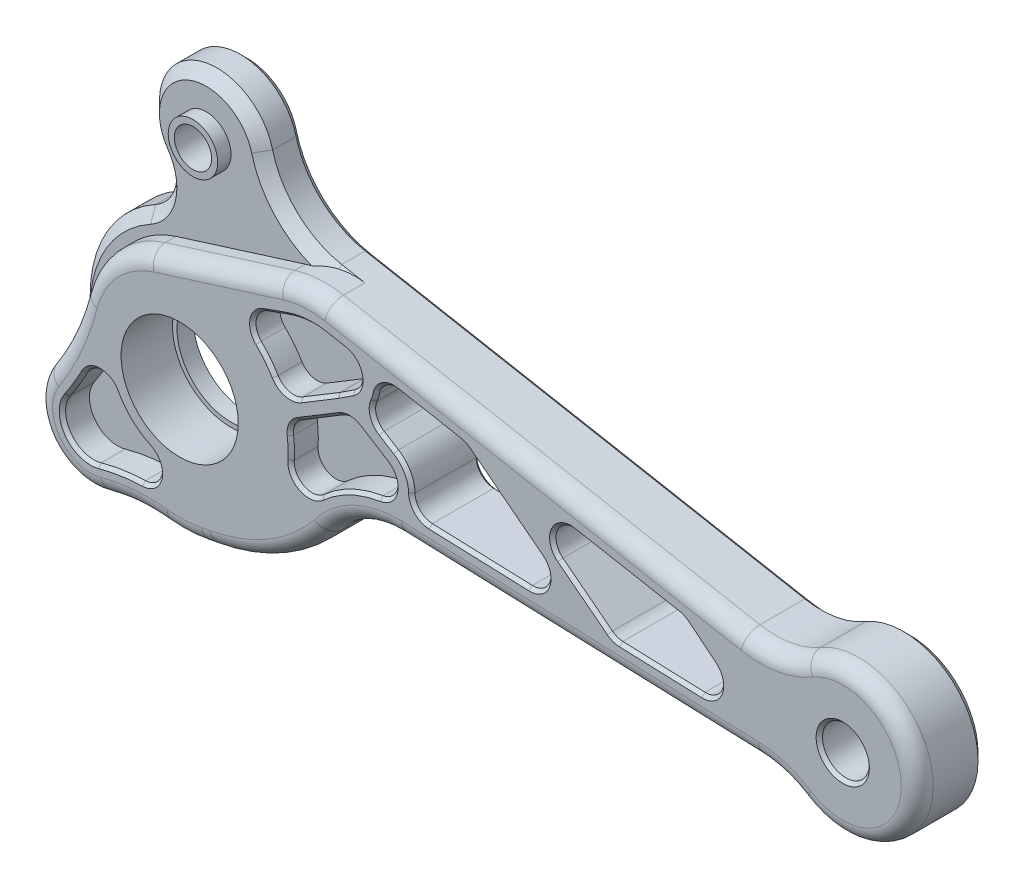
SolidWorks part; units mm, degrees
ref_plane "Front Plane" through (0, 0, 0) normal (0, 0, 1) x (1, 0, 0)
ref_plane "Top Plane" through (0, 0, 0) normal (0, 1, 0) x (1, 0, 0)
ref_plane "Right Plane" through (0, 0, 0) normal (1, 0, 0) x (0, 0, -1)
sketch "Sketch1" plane through (0, 0, 0) normal (0, 0, 1) x (1, 0, 0)
  line L0 (0, 0) -> (-28.1477, -24.9258) construction
  line L4 (105.9708, 13.2321) -> (23.4416, 28.5358)
  line L5 (41.6308, -3.5731) -> (108.5883, -5.962)
  arc A0 (-2.5762, -23.6602) -> (4.6889, -23.3335) centre (0, 0) ccw
  circle A1 centre (0, 0) radius 10.15 construction
  circle A3 centre (0, 38) radius 2.55 construction
  circle A5 centre (124.5, 3.2) radius 2.4 construction
  arc A8 (-22.5882, 7.4976) -> (-23.6545, -2.6279) centre (0, 0) ccw
  arc A10 (-25.2291, -9.2756) -> (-14.0096, -24.5851) centre (-16.7159, -14.8025) ccw
  arc A11 (-2.5762, -23.6602) -> (-14.0096, -24.5851) centre (-5.8775, -53.981) ccw
  arc A12 (-25.2291, -9.2756) -> (-23.6545, -2.6279) centre (-33.7424, -3.7487) ccw
  arc A32 (41.6308, -3.5731) -> (27.7559, -10.2791) centre (41.0425, -20.0626) ccw
  arc A33 (27.6667, -10.3946) -> (27.7559, -10.2791) centre (25.1992, -8.3966) ccw
  arc A34 (6.2288, -23.042) -> (27.6667, -10.3946) centre (0, 12.0088) ccw
  arc A35 (6.2288, -23.042) -> (4.6889, -23.3335) centre (18.4503, -91.8145) ccw
  arc A38 (-11.4624, 20.8579) -> (-22.5882, 7.4976) centre (0, 0) ccw
  arc A39 (-11.4624, 20.8579) -> (-8.8764, 31.8478) centre (-15.1227, 27.5184) ccw
  arc A40 (10.4637, 40.674) -> (-8.8764, 31.8478) centre (0, 38) ccw
  arc A41 (10.4637, 40.674) -> (23.4416, 28.5358) centre (26.45, 44.7593) ccw
  arc A42 (105.9708, 13.2321) -> (117.3757, 15.2517) centre (108.9791, 29.4555) ccw
  arc A43 (116.9262, -8.5745) -> (117.3757, 15.2517) centre (124.5, 3.2) ccw
  arc A44 (116.9262, -8.5745) -> (108.5883, -5.962) centre (108, -22.4515) ccw
  point P4 (-6.3115, 7.1338)
  point P14 (-34.4912, -17.7976)
  point P16 (6.3115, -7.1338)
  point P17 (-21.8683, -32.0652)
  point P24 (-4.971, -23.2751)
other "AlignGroup1"
other "AlignGroup2" parameters "D1"=23.8125, "D3"=10.16, "D4"=3.302, "D2"=8.0988, "D5"=5.1, "D6"=23.8, "D7"=3.302, "D8"=37.6254, "D9"=30.5, "D10"=16.5, "D11"=3.175, "D12"=35.6, "D13"=69.85, "D14"=7.6, "D15"=10.8, "D16"=14, "D17"=16.5, "D18"=6.2303, "D19"=10.4687, "D20"=18.4527, "D21"=23.4601, "D22"=25.1992, "D23"=26.4798, "D24"=27.6663, "D25"=27.7559, "D26"=41.0506, "D27"=41.6379, "D28"=105.938, "D29"=107.9822, "D30"=108.5696, "D31"=108.9577, "D32"=116.9077, "D33"=117.3548, "D34"=124.46, "D35"=2.5775, "D36"=4.9736, "D37"=5.8767, "D38"=8.8542, "D39"=11.4426, "D40"=14.0267, "D41"=15.1043, "D42"=16.7433, "D43"=20.6525, "D44"=22.6, "D45"=23.6693, "D46"=25.2558, "D47"=29.7274, "D48"=33.7682, "D49"=33.9622
extrude "Extrude3" add sketch "Sketch1" along normal mid plane 12.7
sketch "Sketch2" plane through (0, 0, 6.35) normal (0, 0, 1) x (1, 0, 0)
  circle A0 centre (0, 0) radius 10.15
  dimension "D1" = 20.3
extrude "20.30mm CLR HOLE" cut sketch "Sketch2" against normal through all
sketch "Sketch3" plane through (0, 0, 6.35) normal (0, 0, 1) x (1, 0, 0)
  circle A0 centre (0, 0) radius 11
  dimension "D1" = 22
extrude "22mm BEARING BORE 3.05 DP" cut sketch "Sketch3" against normal offset from surface (9.65 mm away) 3.05
sketch "Sketch4" plane through (0, 0, 6.35) normal (0, 0, 1) x (1, 0, 0)
  circle A3 centre (0, 0) radius 11.375
  dimension "D1" = 22.75
sketch "Sketch6" plane through (0, 0, 6.35) normal (0, 0, 1) x (1, 0, 0)
  circle A0 centre (0, 38) radius 1.5875
  dimension "D1" = 3.175
extrude "Extrude8" cut sketch "Sketch6" against normal through all
sketch "Sketch45" plane through (0, 0, 6.35) normal (0, 0, 1) x (1, 0, 0)
  arc A0 (-11.4624, 20.8579) -> (-23.6545, -2.6279) centre (0, 0) ccw construction
  arc A1 (-11.4624, 20.8579) -> (-8.8764, 31.8478) centre (-15.1227, 27.5184) ccw construction
  arc A2 (10.4637, 40.674) -> (23.4416, 28.5358) centre (26.45, 44.7593) ccw construction
  arc A3 (10.4637, 40.674) -> (-8.8764, 31.8478) centre (0, 38) ccw construction
  arc A4 (-11.4624, 20.8579) -> (-23.6545, -2.6279) centre (0, 0) ccw
  arc A5 (-11.4624, 20.8579) -> (-8.8764, 31.8478) centre (-15.1227, 27.5184) ccw
  arc A6 (10.4637, 40.674) -> (23.4416, 28.5358) centre (26.45, 44.7593) ccw
  arc A7 (10.4637, 40.674) -> (-8.8764, 31.8478) centre (0, 38) ccw
  arc A8 (-25.2291, -9.2756) -> (-23.6545, -2.6279) centre (-33.7424, -3.7487) ccw construction
  arc A9 (-25.2291, -9.2756) -> (-23.6545, -2.6279) centre (-33.7424, -3.7487) ccw
sketch "Sketch7" plane through (0, 0, 6.35) normal (0, 0, 1) x (1, 0, 0)
  line L0 (105.9708, 13.2321) -> (23.4416, 28.5358) construction
  line L1 (27.7822, 27.7309) -> (23.4416, 28.5358)
  line L2 (-5.6883, 19.549) -> (18.6308, 27.1782)
  arc A0 (-18.3824, 6.2288) -> (-25.2291, -9.2756) centre (-69.8504, 19.6931) cw
  arc A1 (10.4637, 40.674) -> (23.4416, 28.5358) centre (26.45, 44.7593) ccw construction
  arc A2 (10.4637, 40.674) -> (23.4416, 28.5358) centre (26.45, 44.7593) ccw
  arc A3 (10.4637, 40.674) -> (-8.8764, 31.8478) centre (0, 38) ccw construction
  arc A4 (10.4637, 40.674) -> (-8.8764, 31.8478) centre (0, 38) ccw
  arc A5 (-11.4624, 20.8579) -> (-8.8764, 31.8478) centre (-15.1227, 27.5184) ccw construction
  arc A6 (-11.4624, 20.8579) -> (-8.8764, 31.8478) centre (-15.1227, 27.5184) ccw
  arc A7 (-11.4624, 20.8579) -> (-23.6545, -2.6279) centre (0, 0) ccw construction
  arc A8 (-11.4624, 20.8579) -> (-23.6545, -2.6279) centre (0, 0) ccw
  arc A9 (-25.2291, -9.2756) -> (-23.6545, -2.6279) centre (-33.7424, -3.7487) ccw construction
  arc A10 (-25.2291, -9.2756) -> (-23.6545, -2.6279) centre (-33.7424, -3.7487) ccw
  arc A11 (-25.2291, -9.2756) -> (-14.0096, -24.5851) centre (-16.7159, -14.8025) ccw construction
  arc A12 (-25.2291, -9.2756) -> (-14.0096, -24.5851) centre (-16.7159, -14.8025) ccw construction
  arc A18 (-5.6883, 19.549) -> (-18.3824, 6.2288) centre (-0.001, 1.4202) ccw
  arc A26 (27.7822, 27.7309) -> (19.4046, 27.4031) centre (24.318, 9.0494) ccw
  arc A51 (19.4046, 27.4031) -> (18.6308, 27.1782) centre (24.318, 9.0494) ccw
other "AlignGroup3" parameters "D1"=18.4994, "D3"=20.32, "D4"=42.5781, "D5"=53.25, "D6"=19, "D7"=16.51, "D8"=10.795, "D9"=7.62, "D10"=23.8125, "D2"=19, "D11"=10.4687, "D12"=18.6387, "D13"=19.4049, "D14"=23.4601, "D15"=25.0051, "D16"=26.4798, "D17"=28.4894, "D18"=6.3665, "D19"=8.8542, "D20"=11.4426, "D21"=15.1043, "D22"=16.7433, "D23"=18.252, "D24"=23.8053, "D25"=25.1598, "D26"=25.49, "D27"=33.9622, "D28"=35.3619, "D29"=60.4313, "D30"=69.2739
extrude "Step 5mm dp" cut sketch "Sketch7" against normal blind 5
fillet ".06 Step Radius" [suppressed] radius 1.524
fillet "R 3.0mm " radius 3 16 edges at (1.0689, -23.776, 6.35) (5.458, -23.1835, 6.35) (18.0891, -18.653, 6.35) (27.7119, -10.3374, 6.35) (33.8624, -5.2068, 6.35) (75.1096, -4.7675, 6.35) (112.9333, -6.7063, 6.35) (138.4975, 2.936, 6.35) (111.8563, 13.2083, 6.35) (66.8765, 20.4815, 6.35) (23.1727, 28.0148, 6.35) (6.4713, 23.3636, 6.35) (-13.7554, 14.5281, 6.35) (-21.1844, -1.7978, 6.35) (-24.9028, -20.8022, 6.35) (-8.3368, -23.5803, 6.35)
chamfer "Chamfer2" distance 2 angle 45 6 edges at (15.1791, 32.7086, 1.35) (-4.4839, 47.8252, 1.35) (-7.7248, 25.7776, 1.35) (-21.1233, 10.9656, 1.35) (-23.8657, -6.0882, 1.35) (25.6119, 28.1334, 1.35)
sketch "Sketch8" plane through (0, 0, 1.35) normal (0, 0, 1) x (1, 0, 0)
  circle A0 centre (0, 38) radius 4.65
  dimension "D1" = 9.3
extrude "Extrude9" add sketch "Sketch8" along normal blind 2.5
hole_wizard "Ø7.0 (7) Diameter Hole1" positions "Sketch10" profile "Sketch11" hole size "Ø7.0" standard "ISO"
sketch "Sketch10" plane through (0, 0, 3.85) normal (0, 0, 1) x (1, 0, 0)
  point P0 (0, 38)
sketch "Sketch11" plane through (0, 38, 3.85) normal (1, 0, 0) x (0, -1, 0)
  line L0 (0, 0) -> (0, 10.2)
  line L1 (0, 10.2) -> (3.5, 10.2)
  line L2 (3.5, 10.2) -> (3.5, 0)
  line L5 (3.5, 0) -> (0, 0)
  line L11 (0, -6.35) -> (0, 107.95) construction
  dimension "Thru Hole Dia." = 7
  dimension "Thru Hole Depth" = 10.2
fillet ".06 R" [suppressed] radius 1.524
chamfer "1.3mm x 45" distance 1.3 angle 45 17 edges at (138.4975, 2.936, -6.35) (112.9333, -6.7063, -6.35) (111.8563, 13.2083, -6.35) (75.1096, -4.7675, -6.35) (64.7062, 20.884, -6.35) (33.8624, -5.2068, -6.35) (15.1791, 32.7086, -6.35) (27.7119, -10.3374, -6.35) (-4.4839, 47.8252, -6.35) (18.0891, -18.653, -6.35) (-7.7248, 25.7776, -6.35) (5.458, -23.1835, -6.35) (-21.1233, 10.9656, -6.35) (1.0689, -23.776, -6.35) (-23.8657, -6.0882, -6.35) (-24.9028, -20.8022, -6.35) (-8.3368, -23.5803, -6.35)
sketch "Sketch15" plane through (0, 0, 6.35) normal (0, 0, 1) x (1, 0, 0)
  line L8 (20.3364, 22.0332) -> (15.9787, 20.4881)
  line L9 (22.5352, 9.7587) -> (29.4654, 13.9499)
  line L10 (29.5636, 14.0117) -> (32.2997, 15.7975)
  line L11 (31.0711, 21.9477) -> (27.5602, 22.6008)
  line L12 (38.8231, 7.4304) -> (33.67, 10.6277)
  line L13 (30.1407, 10.6479) -> (22.3905, 5.9608)
  line L16 (-21.1256, -11.8849) -> (-21.1359, -11.9001)
  line L20 (46.8524, 1.3127) -> (65.6342, 0.6441)
  line L21 (67.8244, 6.6898) -> (54.1843, 17.2663)
  line L22 (52.7321, 17.9179) -> (40.835, 20.1312)
  line L23 (37.7861, 11.8103) -> (40.497, 10.1283)
  line L28 (71.3676, 7.9601) -> (80.6715, 0.7458)
  line L29 (82.6214, 0.0394) -> (98.0615, -0.5102)
  line L30 (100.3071, 5.4917) -> (95.2372, 9.5954)
  line L31 (93.7297, 10.2908) -> (74.0556, 13.9509)
  arc A0 (-11.9933, -6.3756) -> (-17.8305, -6.3868) centre (-14.909, -7.9255) ccw
  arc A12 (27.5602, 22.6008) -> (20.3364, 22.0332) centre (25.0051, 8.8665) ccw
  arc A13 (15.9787, 20.4881) -> (14.7326, 14.9017) centre (17.1077, 17.3041) ccw
  arc A14 (17.9011, 10.8933) -> (14.7326, 14.9017) centre (0, 0) ccw
  arc A15 (17.9011, 10.8933) -> (22.5352, 9.7587) centre (20.787, 12.6494) ccw
  arc A16 (29.4654, 13.9499) -> (29.5636, 14.0117) centre (27.7172, 16.8406) ccw
  arc A17 (32.2997, 15.7975) -> (31.0711, 21.9477) centre (30.4532, 18.6264) ccw
  arc A21 (-6.9918, -18.6216) -> (-5.7082, -12.325) centre (-7.0959, -15.3212) ccw
  arc A23 (-11.9933, -6.3756) -> (-5.7082, -12.325) centre (0, 0) ccw
  arc A24 (20.9105, -1.3654) -> (26.5503, -4.0885) centre (24.2815, -1.5856) ccw
  arc A25 (37.5844, 1.2255) -> (26.5503, -4.0885) centre (41.0506, -20.0845) ccw
  arc A26 (37.5844, 1.2255) -> (38.8231, 7.4304) centre (37.042, 4.5598) ccw
  arc A27 (33.67, 10.6277) -> (30.1407, 10.6479) centre (31.8889, 7.7572) ccw
  arc A28 (22.3905, 5.9608) -> (20.7875, 2.6439) centre (24.1387, 3.0701) ccw
  arc A29 (20.9105, -1.3654) -> (20.7875, 2.6439) centre (0, 0) ccw
  arc A38 (43.5946, 4.6449) -> (40.497, 10.1283) centre (37.042, 4.5598) ccw
  arc A39 (43.5946, 4.6449) -> (46.8524, 1.3127) centre (46.9726, 4.6887) ccw
  arc A40 (65.6342, 0.6441) -> (67.8244, 6.6898) centre (65.7543, 4.0202) ccw
  arc A41 (54.1843, 17.2663) -> (52.7321, 17.9179) centre (52.1143, 14.5967) ccw
  arc A42 (40.835, 20.1312) -> (36.8959, 17.4279) centre (40.2171, 16.81) ccw
  arc A43 (36.467, 16.0229) -> (36.8959, 17.4279) centre (30.4532, 18.6264) ccw
  arc A44 (36.467, 16.0229) -> (37.7861, 11.8103) centre (39.5672, 14.6808) ccw
  arc A46 (74.0556, 13.9509) -> (71.3676, 7.9601) centre (73.4377, 10.6297) ccw
  arc A47 (80.6715, 0.7458) -> (82.6214, 0.0394) centre (82.7416, 3.4155) ccw
  arc A48 (98.0615, -0.5102) -> (100.3071, 5.4917) centre (98.1817, 2.8658) ccw
  arc A49 (95.2372, 9.5954) -> (93.7297, 10.2908) centre (93.1118, 6.9696) ccw
  arc A64 (-21.1256, -11.8849) -> (-17.8305, -6.3868) centre (-69.2739, 20.7069) ccw
  arc A65 (-21.1591, -11.936) -> (-21.1359, -11.9001) centre (-33.7682, -3.7202) ccw
  arc A66 (-21.1591, -11.936) -> (-15.3341, -19.8918) centre (-16.7433, -14.8132) ccw
  arc A67 (-6.9918, -18.6216) -> (-15.3341, -19.8918) centre (-5.8767, -53.9735) ccw
extrude "Extrude12" cut sketch "Sketch15" against normal blind 5.08
ref_plane "Plane1" through (0, 0, 0) normal (0, 0, 1) x (1, 0, 0)
mirror "Mirror1" about plane through (0, 0, 0) normal (0, 0, 1) of "Extrude12"
chamfer "Chamfer4" distance 0.6 angle 45 90 edges at (90.3415, -0.2354, 6.35) (101.3457, 1.682, 6.35) (81.5909, 0.2393, 6.35) (97.7722, 7.5435, 6.35) (76.0196, 4.3529, 6.35) (94.5269, 10.0371, 6.35) (70.3555, 12.0126, 6.35) (83.8926, 12.1209, 6.35) (44.557, 2.3271, 6.35) (42.7477, 7.7831, 6.35) (56.2433, 0.9784, 6.35) (39.1416, 10.9693, 6.35) (68.9305, 2.8695, 6.35) (36.3434, 13.6714, 6.35) (61.0044, 11.9781, 6.35) (36.721, 16.7133, 6.35) (53.4972, 17.6789, 6.35) (38.3055, 19.5953, 6.35) (46.7836, 19.0245, 6.35) (20.9452, 0.6422, 6.35) (22.8127, -4.6277, 6.35) (21.0971, 4.5401, 6.35) (31.6827, -0.6327, 6.35) (26.2656, 8.3043, 6.35) (40.3548, 3.8985, 6.35) (31.9082, 11.1353, 6.35) (36.2465, 9.0291, 6.35) (19.9836, 9.3681, 6.35) (26.0003, 11.8543, 6.35) (16.4395, 12.9944, 6.35) (29.5148, 13.9804, 6.35) (13.8105, 18.0396, 6.35) (30.9316, 14.9046, 6.35) (18.1575, 21.2606, 6.35) (33.766, 19.2882, 6.35) (23.9109, 22.7935, 6.35) (29.3157, 22.2742, 6.35) (-21.1475, -11.9181, 6.35) (-20.9958, -17.9268, 6.35) (-11.2009, -19.007, 6.35) (-3.8604, -15.9808, 6.35) (-21.1307, -11.8925, 6.35) (-9.3373, -9.8643, 6.35) (-19.4022, -9.1813, 6.35) (-14.9153, -4.6235, 6.35) (-21.1475, -11.9181, -6.35) (-20.9958, -17.9268, -6.35) (-11.2009, -19.007, -6.35) (-3.8604, -15.9808, -6.35) (-21.1307, -11.8925, -6.35) (-9.3373, -9.8643, -6.35) (-19.4022, -9.1813, -6.35) (-14.9153, -4.6235, -6.35) (22.8127, -4.6277, -6.35) (31.6827, -0.6327, -6.35) (20.9452, 0.6422, -6.35) (40.3548, 3.8985, -6.35) (21.0971, 4.5401, -6.35) (36.2465, 9.0291, -6.35) (26.2656, 8.3043, -6.35) (31.9082, 11.1353, -6.35) (26.0003, 11.8543, -6.35) (29.5148, 13.9804, -6.35) (19.9836, 9.3681, -6.35) (30.9316, 14.9046, -6.35) (16.4395, 12.9944, -6.35) (33.766, 19.2882, -6.35) (13.8105, 18.0396, -6.35) (29.3157, 22.2742, -6.35) (18.1575, 21.2606, -6.35) (23.9109, 22.7935, -6.35) (44.557, 2.3271, -6.35) (42.7477, 7.7831, -6.35) (56.2433, 0.9784, -6.35) (39.1416, 10.9693, -6.35) (68.9305, 2.8695, -6.35) (36.3434, 13.6714, -6.35) (61.0044, 11.9781, -6.35) (36.721, 16.7133, -6.35) (53.4972, 17.6789, -6.35) (38.3055, 19.5953, -6.35) (46.7836, 19.0245, -6.35) (90.3415, -0.2354, -6.35) (101.3457, 1.682, -6.35) (81.5909, 0.2393, -6.35) (97.7722, 7.5435, -6.35) (76.0196, 4.3529, -6.35) (94.5269, 10.0371, -6.35) (70.3555, 12.0126, -6.35) (83.8926, 12.1209, -6.35)
hole_wizard " M10x1.25 Tapped Hole1" positions "Sketch20" profile "Sketch21" tap size "M10x1.25" standard "ISO"
sketch "Sketch20" plane through (0, 0, 6.35) normal (0, 0, 1) x (1, 0, 0)
  point P0 (124.5, 3.2)
sketch "Sketch21" plane through (124.5, 3.2, 6.35) normal (1, 0, 0) x (0, -1, 0)
  line L0 (0, 0) -> (0, 12.7)
  line L1 (0, 12.7) -> (4.4, 12.7)
  line L2 (4.4, 12.7) -> (4.4, 0)
  line L5 (4.4, 0) -> (0, 0)
  line L11 (0, -6.35) -> (0, 107.95) construction
  dimension "Thru Tap Drill Dia." = 8.8
  dimension "Thru Tap Drill Depth" = 12.7
chamfer "Chamfer5" distance 0.6 angle 45 1 edges at (128.9, 3.2, 6.35)
sketch "Sketch22" plane through (0, 0, 6.35) normal (0, 0, 1) x (1, 0, 0)
  point P0 (0, 0)
move or copy body "Body-Move/Copy1" bodies to move or copy 120 copy no translate (0, 0, -6.35)
sketch "Sketch23" plane through (0, 0, -5.08) normal (0, 0, 1) x (1, 0, 0)
  line L4 (46.8524, 1.3127) -> (65.6342, 0.6441)
  line L5 (67.8244, 6.6898) -> (54.1843, 17.2663)
  line L6 (52.7321, 17.9179) -> (40.835, 20.1312)
  line L7 (37.7861, 11.8103) -> (40.497, 10.1283)
  line L8 (46.8524, 1.3127) -> (65.6342, 0.6441)
  line L9 (67.8244, 6.6898) -> (54.1843, 17.2663)
  line L10 (52.7321, 17.9179) -> (40.835, 20.1312)
  line L11 (37.7861, 11.8103) -> (40.497, 10.1283)
  line L12 (71.3676, 7.9601) -> (80.6715, 0.7458)
  line L13 (82.6214, 0.0394) -> (98.0615, -0.5102)
  line L14 (100.3071, 5.4917) -> (95.2372, 9.5954)
  line L15 (93.7297, 10.2908) -> (74.0556, 13.9509)
  line L16 (71.3676, 7.9601) -> (80.6715, 0.7458)
  line L17 (82.6214, 0.0394) -> (98.0615, -0.5102)
  line L18 (100.3071, 5.4917) -> (95.2372, 9.5954)
  line L19 (93.7297, 10.2908) -> (74.0556, 13.9509)
  arc A4 (74.0556, 13.9509) -> (71.3676, 7.9601) centre (73.4377, 10.6297) ccw
  arc A5 (80.6715, 0.7458) -> (82.6214, 0.0394) centre (82.7416, 3.4155) ccw
  arc A6 (98.0615, -0.5102) -> (100.3071, 5.4917) centre (98.1817, 2.8658) ccw
  arc A7 (43.5946, 4.6449) -> (46.8524, 1.3127) centre (46.9726, 4.6887) ccw
  arc A8 (65.6342, 0.6441) -> (67.8244, 6.6898) centre (65.7543, 4.0202) ccw
  arc A9 (54.1843, 17.2663) -> (52.7321, 17.9179) centre (52.1143, 14.5967) ccw
  arc A10 (40.835, 20.1312) -> (36.8959, 17.4279) centre (40.2171, 16.81) ccw
  arc A11 (36.467, 16.0229) -> (36.8959, 17.4279) centre (30.4532, 18.6264) ccw
  arc A12 (36.467, 16.0229) -> (37.7861, 11.8103) centre (39.5672, 14.6808) ccw
  arc A13 (43.5946, 4.6449) -> (40.497, 10.1283) centre (37.042, 4.5598) ccw
  arc A14 (43.5946, 4.6449) -> (46.8524, 1.3127) centre (46.9726, 4.6887) ccw
  arc A15 (65.6342, 0.6441) -> (67.8244, 6.6898) centre (65.7543, 4.0202) ccw
  arc A16 (54.1843, 17.2663) -> (52.7321, 17.9179) centre (52.1143, 14.5967) ccw
  arc A17 (40.835, 20.1312) -> (36.8959, 17.4279) centre (40.2171, 16.81) ccw
  arc A18 (36.467, 16.0229) -> (36.8959, 17.4279) centre (30.4532, 18.6264) ccw
  arc A19 (36.467, 16.0229) -> (37.7861, 11.8103) centre (39.5672, 14.6808) ccw
  arc A20 (43.5946, 4.6449) -> (40.497, 10.1283) centre (37.042, 4.5598) ccw
  arc A21 (95.2372, 9.5954) -> (93.7297, 10.2908) centre (93.1118, 6.9696) ccw
  arc A22 (74.0556, 13.9509) -> (71.3676, 7.9601) centre (73.4377, 10.6297) ccw
  arc A23 (80.6715, 0.7458) -> (82.6214, 0.0394) centre (82.7416, 3.4155) ccw
  arc A24 (98.0615, -0.5102) -> (100.3071, 5.4917) centre (98.1817, 2.8658) ccw
  arc A25 (95.2372, 9.5954) -> (93.7297, 10.2908) centre (93.1118, 6.9696) ccw
  dimension "D1" = 0
  dimension "D2" = 0
extrude "Extrude13" cut sketch "Sketch23" against normal through all
sketch "Extrusion" plane through (0, 0, 0) normal (0, 0, 1) x (1, 0, 0)
  line L4 (41.5176, -6.7461) -> (108.4751, -9.135)
  line L5 (106.5496, 16.3539) -> (24.0205, 31.6576)
  line L6 (41.5176, -6.7461) -> (108.4751, -9.135)
  line L7 (106.5496, 16.3539) -> (24.0205, 31.6576)
  arc A30 (30.1341, -12.3927) -> (30.3126, -12.1617) centre (25.1992, -8.3966) ccw
  arc A31 (41.5176, -6.7461) -> (30.3126, -12.1617) centre (41.0425, -20.0626) ccw
  arc A32 (115.2086, -11.2447) -> (108.4751, -9.135) centre (108, -22.4515) ccw
  arc A33 (115.2086, -11.2447) -> (115.76, 17.9849) centre (124.5, 3.2) ccw
  arc A34 (106.5496, 16.3539) -> (115.76, 17.9849) centre (108.9791, 29.4555) ccw
  arc A35 (13.5399, 41.4601) -> (24.0205, 31.6576) centre (26.45, 44.7593) ccw
  arc A36 (13.5399, 41.4601) -> (-11.4859, 30.0391) centre (0, 38) ccw
  arc A37 (-12.9916, 23.6404) -> (-11.4859, 30.0391) centre (-15.1227, 27.5184) ccw
  arc A38 (-12.9916, 23.6404) -> (-26.8101, -2.9785) centre (0, 0) ccw
  arc A39 (-27.8922, -7.5467) -> (-26.8101, -2.9785) centre (-33.7424, -3.7487) ccw
  arc A40 (-27.8922, -7.5467) -> (-13.1631, -27.6451) centre (-16.7159, -14.8025) ccw
  arc A41 (-2.9198, -26.8165) -> (-13.1631, -27.6451) centre (-5.8775, -53.981) ccw
  arc A42 (-2.9198, -26.8165) -> (5.3144, -26.4463) centre (0, 0) ccw
  arc A43 (6.7843, -26.1681) -> (5.3144, -26.4463) centre (18.4503, -91.8145) ccw
  arc A44 (6.7843, -26.1681) -> (30.1341, -12.3927) centre (0, 12.0088) ccw
  arc A45 (30.1341, -12.3927) -> (30.3126, -12.1617) centre (25.1992, -8.3966) ccw
  arc A46 (41.5176, -6.7461) -> (30.3126, -12.1617) centre (41.0425, -20.0626) ccw
  arc A47 (115.2086, -11.2447) -> (108.4751, -9.135) centre (108, -22.4515) ccw
  arc A48 (115.2086, -11.2447) -> (115.76, 17.9849) centre (124.5, 3.2) ccw
  arc A49 (106.5496, 16.3539) -> (115.76, 17.9849) centre (108.9791, 29.4555) ccw
  arc A50 (13.5399, 41.4601) -> (24.0205, 31.6576) centre (26.45, 44.7593) ccw
  arc A51 (13.5399, 41.4601) -> (-11.4859, 30.0391) centre (0, 38) ccw
  arc A52 (-12.9916, 23.6404) -> (-11.4859, 30.0391) centre (-15.1227, 27.5184) ccw
  arc A53 (-12.9916, 23.6404) -> (-26.8101, -2.9785) centre (0, 0) ccw
  arc A54 (-27.8922, -7.5467) -> (-26.8101, -2.9785) centre (-33.7424, -3.7487) ccw
  arc A55 (-27.8922, -7.5467) -> (-13.1631, -27.6451) centre (-16.7159, -14.8025) ccw
  arc A56 (-2.9198, -26.8165) -> (-13.1631, -27.6451) centre (-5.8775, -53.981) ccw
  arc A57 (-2.9198, -26.8165) -> (5.3144, -26.4463) centre (0, 0) ccw
  arc A58 (6.7843, -26.1681) -> (5.3144, -26.4463) centre (18.4503, -91.8145) ccw
  arc A59 (6.7843, -26.1681) -> (30.1341, -12.3927) centre (0, 12.0088) ccw
  dimension "D1" = 3.175
sketch "OPEN-POCKET_OP-1" plane through (0, 0, 0) normal (0, 0, 1) x (1, 0, 0)
  line L0 (105.9708, 13.2321) -> (23.4416, 28.5358) construction
  line L1 (41.6308, -3.5731) -> (108.5883, -5.962) construction
  line L2 (105.9708, 13.2321) -> (23.4416, 28.5358)
  line L3 (41.6308, -3.5731) -> (108.5883, -5.962)
  arc A0 (-2.5762, -23.6602) -> (-14.0096, -24.5851) centre (-5.8775, -53.981) ccw construction
  arc A1 (-25.2291, -9.2756) -> (-14.0096, -24.5851) centre (-16.7159, -14.8025) ccw construction
  arc A2 (-25.2291, -9.2756) -> (-23.6545, -2.6279) centre (-33.7424, -3.7487) ccw construction
  arc A3 (-11.4624, 20.8579) -> (-23.6545, -2.6279) centre (0, 0) ccw construction
  arc A4 (-11.4624, 20.8579) -> (-8.8764, 31.8478) centre (-15.1227, 27.5184) ccw construction
  arc A5 (10.4637, 40.674) -> (-8.8764, 31.8478) centre (0, 38) ccw construction
  arc A6 (10.4637, 40.674) -> (23.4416, 28.5358) centre (26.45, 44.7593) ccw construction
  arc A7 (105.9708, 13.2321) -> (117.3757, 15.2517) centre (108.9791, 29.4555) ccw construction
  arc A8 (116.9262, -8.5745) -> (117.3757, 15.2517) centre (124.5, 3.2) ccw construction
  arc A9 (116.9262, -8.5745) -> (108.5883, -5.962) centre (108, -22.4515) ccw construction
  arc A10 (41.6308, -3.5731) -> (27.7559, -10.2791) centre (41.0425, -20.0626) ccw construction
  arc A11 (27.6667, -10.3946) -> (27.7559, -10.2791) centre (25.1992, -8.3966) ccw construction
  arc A12 (6.2288, -23.042) -> (27.6667, -10.3946) centre (0, 12.0088) ccw construction
  arc A13 (6.2288, -23.042) -> (4.6889, -23.3335) centre (18.4503, -91.8145) ccw construction
  arc A14 (-2.5762, -23.6602) -> (4.6889, -23.3335) centre (0, 0) ccw construction
  arc A15 (-2.5762, -23.6602) -> (-14.0096, -24.5851) centre (-5.8775, -53.981) ccw
  arc A16 (-25.2291, -9.2756) -> (-14.0096, -24.5851) centre (-16.7159, -14.8025) ccw
  arc A17 (-25.2291, -9.2756) -> (-23.6545, -2.6279) centre (-33.7424, -3.7487) ccw
  arc A18 (-11.4624, 20.8579) -> (-23.6545, -2.6279) centre (0, 0) ccw
  arc A19 (-11.4624, 20.8579) -> (-8.8764, 31.8478) centre (-15.1227, 27.5184) ccw
  arc A20 (10.4637, 40.674) -> (-8.8764, 31.8478) centre (0, 38) ccw
  arc A21 (10.4637, 40.674) -> (23.4416, 28.5358) centre (26.45, 44.7593) ccw
  arc A22 (105.9708, 13.2321) -> (117.3757, 15.2517) centre (108.9791, 29.4555) ccw
  arc A23 (116.9262, -8.5745) -> (117.3757, 15.2517) centre (124.5, 3.2) ccw
  arc A24 (116.9262, -8.5745) -> (108.5883, -5.962) centre (108, -22.4515) ccw
  arc A25 (41.6308, -3.5731) -> (27.7559, -10.2791) centre (41.0425, -20.0626) ccw
  arc A26 (27.6667, -10.3946) -> (27.7559, -10.2791) centre (25.1992, -8.3966) ccw
  arc A27 (6.2288, -23.042) -> (27.6667, -10.3946) centre (0, 12.0088) ccw
  arc A28 (6.2288, -23.042) -> (4.6889, -23.3335) centre (18.4503, -91.8145) ccw
  arc A29 (-2.5762, -23.6602) -> (4.6889, -23.3335) centre (0, 0) ccw
ref_plane "Plane2" through (0, 0, -9.525) normal (0, 0, -1) x (-1, 0, 0)
sketch "Sketch25" plane through (0, 0, 0) normal (0, 0, 1) x (1, 0, 0)
  line L0 (-26.8658, -14.7846) -> (30.6063, 7.2087)
  line L12 (109.0411, 6.7299) -> (42.0836, 9.1188)
  line L13 (138.4407, 1.9131) -> (42.0836, 9.1188)
  circle A1 centre (46.644, -76.6279) radius 25.4 construction
  arc A3 (-25.2291, -9.2756) -> (-14.0096, -24.5851) centre (-16.7159, -14.8025) ccw construction
  arc A4 (116.9262, -8.5745) -> (117.3757, 15.2517) centre (124.5, 3.2) ccw construction
  arc A55 (-1.2015, -11.0348) -> (-17.3958, -12.3448) centre (-5.8775, -53.981) ccw
  arc A56 (-1.2015, -11.0348) -> (2.1868, -10.8825) centre (0, 0) ccw
  arc A57 (4.0067, -10.5379) -> (2.1868, -10.8825) centre (18.4503, -91.8145) ccw
  arc A58 (4.0067, -10.5379) -> (17.6838, -2.5409) centre (0, 12.0088) ccw
  arc A59 (42.0836, 9.1188) -> (17.6838, -2.5409) centre (41.0425, -20.0626) ccw
  arc A64 (42.0836, 9.1188) -> (30.6063, 7.2087) centre (41.0425, -20.0626) ccw
  dimension "D2" = 50.8
  dimension "D1" = 12.7
ref_plane "Plane3" through (0, 0, 1.27) normal (0, 0, 1) x (1, 0, 0)
sketch "Part Profile" plane through (0, 0, 1.27) normal (0, 0, 1) x (1, 0, 0)
  line L0 (41.6308, -3.5731) -> (108.5883, -5.962) construction
  line L1 (105.9708, 13.2321) -> (23.4416, 28.5358) construction
  line L2 (41.6308, -3.5731) -> (108.5883, -5.962)
  line L3 (105.9708, 13.2321) -> (23.4416, 28.5358)
  arc A0 (10.4637, 40.674) -> (-8.8764, 31.8478) centre (0, 38) ccw construction
  arc A1 (-11.4624, 20.8579) -> (-8.8764, 31.8478) centre (-15.1227, 27.5184) ccw construction
  arc A2 (-11.4624, 20.8579) -> (-23.6545, -2.6279) centre (0, 0) ccw construction
  arc A3 (-25.2291, -9.2756) -> (-23.6545, -2.6279) centre (-33.7424, -3.7487) ccw construction
  arc A4 (-25.2291, -9.2756) -> (-14.0096, -24.5851) centre (-16.7159, -14.8025) ccw construction
  arc A5 (-2.5762, -23.6602) -> (-14.0096, -24.5851) centre (-5.8775, -53.981) ccw construction
  arc A6 (-2.5762, -23.6602) -> (4.6889, -23.3335) centre (0, 0) ccw construction
  arc A7 (6.2288, -23.042) -> (4.6889, -23.3335) centre (18.4503, -91.8145) ccw construction
  arc A8 (6.2288, -23.042) -> (27.6667, -10.3946) centre (0, 12.0088) ccw construction
  arc A9 (27.6667, -10.3946) -> (27.7559, -10.2791) centre (25.1992, -8.3966) ccw construction
  arc A10 (41.6308, -3.5731) -> (27.7559, -10.2791) centre (41.0425, -20.0626) ccw construction
  arc A11 (116.9262, -8.5745) -> (108.5883, -5.962) centre (108, -22.4515) ccw construction
  arc A12 (116.9262, -8.5745) -> (117.3757, 15.2517) centre (124.5, 3.2) ccw construction
  arc A13 (105.9708, 13.2321) -> (117.3757, 15.2517) centre (108.9791, 29.4555) ccw construction
  arc A14 (10.4637, 40.674) -> (23.4416, 28.5358) centre (26.45, 44.7593) ccw construction
  arc A15 (10.4637, 40.674) -> (-8.8764, 31.8478) centre (0, 38) ccw
  arc A16 (-11.4624, 20.8579) -> (-8.8764, 31.8478) centre (-15.1227, 27.5184) ccw
  arc A17 (-11.4624, 20.8579) -> (-23.6545, -2.6279) centre (0, 0) ccw
  arc A18 (-25.2291, -9.2756) -> (-23.6545, -2.6279) centre (-33.7424, -3.7487) ccw
  arc A19 (-25.2291, -9.2756) -> (-14.0096, -24.5851) centre (-16.7159, -14.8025) ccw
  arc A20 (-2.5762, -23.6602) -> (-14.0096, -24.5851) centre (-5.8775, -53.981) ccw
  arc A21 (-2.5762, -23.6602) -> (4.6889, -23.3335) centre (0, 0) ccw
  arc A22 (6.2288, -23.042) -> (4.6889, -23.3335) centre (18.4503, -91.8145) ccw
  arc A23 (6.2288, -23.042) -> (27.6667, -10.3946) centre (0, 12.0088) ccw
  arc A24 (27.6667, -10.3946) -> (27.7559, -10.2791) centre (25.1992, -8.3966) ccw
  arc A25 (41.6308, -3.5731) -> (27.7559, -10.2791) centre (41.0425, -20.0626) ccw
  arc A26 (116.9262, -8.5745) -> (108.5883, -5.962) centre (108, -22.4515) ccw
  arc A27 (116.9262, -8.5745) -> (117.3757, 15.2517) centre (124.5, 3.2) ccw
  arc A28 (105.9708, 13.2321) -> (117.3757, 15.2517) centre (108.9791, 29.4555) ccw
  arc A29 (10.4637, 40.674) -> (23.4416, 28.5358) centre (26.45, 44.7593) ccw
sketch "Sketch28" plane through (0, 0, 1.27) normal (0, 0, 1) x (1, 0, 0)
  line L0 (41.6308, -3.5731) -> (108.5883, -5.962) construction
  line L1 (105.9708, 13.2321) -> (23.4416, 28.5358) construction
  line L2 (41.6308, -3.5731) -> (108.5883, -5.962)
  line L3 (105.9708, 13.2321) -> (23.4416, 28.5358)
  arc A0 (-11.4624, 20.8579) -> (-23.6545, -2.6279) centre (0, 0) ccw construction
  arc A1 (-25.2291, -9.2756) -> (-23.6545, -2.6279) centre (-33.7424, -3.7487) ccw construction
  arc A2 (-25.2291, -9.2756) -> (-14.0096, -24.5851) centre (-16.7159, -14.8025) ccw construction
  arc A3 (-2.5762, -23.6602) -> (-14.0096, -24.5851) centre (-5.8775, -53.981) ccw construction
  arc A4 (-2.5762, -23.6602) -> (4.6889, -23.3335) centre (0, 0) ccw construction
  arc A5 (6.2288, -23.042) -> (4.6889, -23.3335) centre (18.4503, -91.8145) ccw construction
  arc A6 (6.2288, -23.042) -> (27.6667, -10.3946) centre (0, 12.0088) ccw construction
  arc A7 (27.6667, -10.3946) -> (27.7559, -10.2791) centre (25.1992, -8.3966) ccw construction
  arc A8 (41.6308, -3.5731) -> (27.7559, -10.2791) centre (41.0425, -20.0626) ccw construction
  arc A9 (116.9262, -8.5745) -> (108.5883, -5.962) centre (108, -22.4515) ccw construction
  arc A10 (116.9262, -8.5745) -> (117.3757, 15.2517) centre (124.5, 3.2) ccw construction
  arc A11 (105.9708, 13.2321) -> (117.3757, 15.2517) centre (108.9791, 29.4555) ccw construction
  arc A12 (10.4637, 40.674) -> (23.4416, 28.5358) centre (26.45, 44.7593) ccw construction
  arc A13 (10.4637, 40.674) -> (-8.8764, 31.8478) centre (0, 38) ccw construction
  arc A14 (-11.4624, 20.8579) -> (-8.8764, 31.8478) centre (-15.1227, 27.5184) ccw construction
  arc A15 (-11.4624, 20.8579) -> (-23.6545, -2.6279) centre (0, 0) ccw
  arc A16 (-25.2291, -9.2756) -> (-23.6545, -2.6279) centre (-33.7424, -3.7487) ccw
  arc A17 (-25.2291, -9.2756) -> (-14.0096, -24.5851) centre (-16.7159, -14.8025) ccw
  arc A18 (-2.5762, -23.6602) -> (-14.0096, -24.5851) centre (-5.8775, -53.981) ccw
  arc A19 (-2.5762, -23.6602) -> (4.6889, -23.3335) centre (0, 0) ccw
  arc A20 (6.2288, -23.042) -> (4.6889, -23.3335) centre (18.4503, -91.8145) ccw
  arc A21 (6.2288, -23.042) -> (27.6667, -10.3946) centre (0, 12.0088) ccw
  arc A22 (27.6667, -10.3946) -> (27.7559, -10.2791) centre (25.1992, -8.3966) ccw
  arc A23 (41.6308, -3.5731) -> (27.7559, -10.2791) centre (41.0425, -20.0626) ccw
  arc A24 (116.9262, -8.5745) -> (108.5883, -5.962) centre (108, -22.4515) ccw
  arc A25 (116.9262, -8.5745) -> (117.3757, 15.2517) centre (124.5, 3.2) ccw
  arc A26 (105.9708, 13.2321) -> (117.3757, 15.2517) centre (108.9791, 29.4555) ccw
  arc A27 (10.4637, 40.674) -> (23.4416, 28.5358) centre (26.45, 44.7593) ccw
  arc A28 (10.4637, 40.674) -> (-8.8764, 31.8478) centre (0, 38) ccw
  arc A29 (-11.4624, 20.8579) -> (-8.8764, 31.8478) centre (-15.1227, 27.5184) ccw
sketch "Sketch29" plane through (0, 0, -5) normal (0, 0, 1) x (1, 0, 0)
  line L0 (23.4416, 28.5358) -> (27.7822, 27.7309) construction
  line L1 (23.4416, 28.5358) -> (27.7822, 27.7309)
  line L3 (-5.6883, 19.549) -> (18.6308, 27.1782) construction
  line L4 (-5.6883, 19.549) -> (18.6308, 27.1782)
  arc A2 (-11.4624, 20.8579) -> (-8.8764, 31.8478) centre (-15.1227, 27.5184) ccw construction
  arc A3 (10.4637, 40.674) -> (-8.8764, 31.8478) centre (0, 38) ccw construction
  arc A4 (10.4637, 40.674) -> (23.4416, 28.5358) centre (26.45, 44.7593) ccw construction
  arc A6 (-11.4624, 20.8579) -> (-23.6545, -2.6279) centre (0, 0) ccw construction
  arc A7 (-11.4624, 20.8579) -> (-8.8764, 31.8478) centre (-15.1227, 27.5184) ccw
  arc A8 (10.4637, 40.674) -> (-8.8764, 31.8478) centre (0, 38) ccw
  arc A9 (10.4637, 40.674) -> (23.4416, 28.5358) centre (26.45, 44.7593) ccw
  arc A12 (19.7863, 27.5011) -> (18.6308, 27.1782) centre (24.318, 9.0494) ccw construction
  arc A13 (-25.2291, -9.2756) -> (-23.6545, -2.6279) centre (-33.7424, -3.7487) ccw construction
  arc A15 (19.7863, 27.5011) -> (18.6308, 27.1782) centre (24.318, 9.0494) ccw
  arc A16 (23.3468, 28.0246) -> (19.7863, 27.5011) centre (24.318, 9.0494) ccw construction
  arc A17 (27.7822, 27.7309) -> (23.3468, 28.0246) centre (24.318, 9.0494) ccw construction
  arc A18 (23.3468, 28.0246) -> (19.7863, 27.5011) centre (24.318, 9.0494) ccw
  arc A19 (27.7822, 27.7309) -> (23.3468, 28.0246) centre (24.318, 9.0494) ccw
  arc A21 (-25.2291, -9.2756) -> (-21.6309, -2.7819) centre (-69.8504, 19.6931) ccw construction
  arc A23 (-21.6309, -2.7819) -> (-18.3824, 6.2288) centre (-69.8504, 19.6931) ccw construction
  arc A25 (-5.6883, 19.549) -> (-18.3824, 6.2288) centre (-0.001, 1.4202) ccw construction
  arc A26 (-11.4624, 20.8579) -> (-23.6545, -2.6279) centre (0, 0) ccw
  arc A27 (-25.2291, -9.2756) -> (-23.6545, -2.6279) centre (-33.7424, -3.7487) ccw
  arc A28 (-25.2291, -9.2756) -> (-21.6309, -2.7819) centre (-69.8504, 19.6931) ccw
  arc A29 (-21.6309, -2.7819) -> (-18.3824, 6.2288) centre (-69.8504, 19.6931) ccw
  arc A30 (-5.6883, 19.549) -> (-18.3824, 6.2288) centre (-0.001, 1.4202) ccw
sketch "Sketch31" plane through (0, 0, 0) normal (0, 0, 1) x (1, 0, 0)
  line L0 (93.7297, 10.2908) -> (74.0556, 13.9509) construction
  line L1 (100.3071, 5.4917) -> (95.2372, 9.5954) construction
  line L2 (82.6214, 0.0394) -> (98.0615, -0.5102) construction
  line L3 (71.3676, 7.9601) -> (80.6715, 0.7458) construction
  line L4 (93.7297, 10.2908) -> (74.0556, 13.9509)
  line L5 (100.3071, 5.4917) -> (95.2372, 9.5954)
  line L6 (82.6214, 0.0394) -> (98.0615, -0.5102)
  line L7 (71.3676, 7.9601) -> (80.6715, 0.7458)
  arc A0 (74.0556, 13.9509) -> (71.3676, 7.9601) centre (73.4377, 10.6297) ccw construction
  arc A1 (95.2372, 9.5954) -> (93.7297, 10.2908) centre (93.1118, 6.9696) ccw construction
  arc A2 (98.0615, -0.5102) -> (100.3071, 5.4917) centre (98.1817, 2.8658) ccw construction
  arc A3 (80.6715, 0.7458) -> (82.6214, 0.0394) centre (82.7416, 3.4155) ccw construction
  arc A4 (74.0556, 13.9509) -> (71.3676, 7.9601) centre (73.4377, 10.6297) ccw
  arc A5 (95.2372, 9.5954) -> (93.7297, 10.2908) centre (93.1118, 6.9696) ccw
  arc A6 (98.0615, -0.5102) -> (100.3071, 5.4917) centre (98.1817, 2.8658) ccw
  arc A7 (80.6715, 0.7458) -> (82.6214, 0.0394) centre (82.7416, 3.4155) ccw
sketch "Sketch32" plane through (0, 0, 0) normal (0, 0, 1) x (1, 0, 0)
  circle A0 centre (124.5, 3.2) radius 4.4 construction
  circle A1 centre (124.5, 3.2) radius 4.4
sketch "Sketch33" plane through (0, 0, -12.7) normal (0, 0, -1) x (-1, 0, 0)
  line L0 (-105.9708, 13.2321) -> (-23.4416, 28.5358) construction
  line L1 (-41.6308, -3.5731) -> (-108.5883, -5.962) construction
  line L2 (-105.9708, 13.2321) -> (-23.4416, 28.5358)
  line L3 (-41.6308, -3.5731) -> (-108.5883, -5.962)
  arc A0 (-27.6667, -10.3946) -> (-6.2288, -23.042) centre (0, 12.0088) ccw construction
  arc A1 (-4.6889, -23.3335) -> (-6.2288, -23.042) centre (-18.4503, -91.8145) ccw construction
  arc A2 (-4.6889, -23.3335) -> (2.5762, -23.6602) centre (0, 0) ccw construction
  arc A3 (14.0096, -24.5851) -> (2.5762, -23.6602) centre (5.8775, -53.981) ccw construction
  arc A4 (14.0096, -24.5851) -> (25.2291, -9.2756) centre (16.7159, -14.8025) ccw construction
  arc A5 (23.6545, -2.6279) -> (25.2291, -9.2756) centre (33.7424, -3.7487) ccw construction
  arc A6 (23.6545, -2.6279) -> (11.4624, 20.8579) centre (0, 0) ccw construction
  arc A7 (8.8764, 31.8478) -> (11.4624, 20.8579) centre (15.1227, 27.5184) ccw construction
  arc A8 (8.8764, 31.8478) -> (-10.4637, 40.674) centre (0, 38) ccw construction
  arc A9 (-23.4416, 28.5358) -> (-10.4637, 40.674) centre (-26.45, 44.7593) ccw construction
  arc A10 (-117.3757, 15.2517) -> (-105.9708, 13.2321) centre (-108.9791, 29.4555) ccw construction
  arc A11 (-117.3757, 15.2517) -> (-116.9262, -8.5745) centre (-124.5, 3.2) ccw construction
  arc A12 (-108.5883, -5.962) -> (-116.9262, -8.5745) centre (-108, -22.4515) ccw construction
  arc A13 (-27.7559, -10.2791) -> (-41.6308, -3.5731) centre (-41.0425, -20.0626) ccw construction
  arc A14 (-27.7559, -10.2791) -> (-27.6667, -10.3946) centre (-25.1992, -8.3966) ccw construction
  arc A15 (-27.6667, -10.3946) -> (-6.2288, -23.042) centre (0, 12.0088) ccw
  arc A16 (-4.6889, -23.3335) -> (-6.2288, -23.042) centre (-18.4503, -91.8145) ccw
  arc A17 (-4.6889, -23.3335) -> (2.5762, -23.6602) centre (0, 0) ccw
  arc A18 (14.0096, -24.5851) -> (2.5762, -23.6602) centre (5.8775, -53.981) ccw
  arc A19 (14.0096, -24.5851) -> (25.2291, -9.2756) centre (16.7159, -14.8025) ccw
  arc A20 (23.6545, -2.6279) -> (25.2291, -9.2756) centre (33.7424, -3.7487) ccw
  arc A21 (23.6545, -2.6279) -> (11.4624, 20.8579) centre (0, 0) ccw
  arc A22 (8.8764, 31.8478) -> (11.4624, 20.8579) centre (15.1227, 27.5184) ccw
  arc A23 (8.8764, 31.8478) -> (-10.4637, 40.674) centre (0, 38) ccw
  arc A24 (-23.4416, 28.5358) -> (-10.4637, 40.674) centre (-26.45, 44.7593) ccw
  arc A25 (-117.3757, 15.2517) -> (-105.9708, 13.2321) centre (-108.9791, 29.4555) ccw
  arc A26 (-117.3757, 15.2517) -> (-116.9262, -8.5745) centre (-124.5, 3.2) ccw
  arc A27 (-108.5883, -5.962) -> (-116.9262, -8.5745) centre (-108, -22.4515) ccw
  arc A28 (-27.7559, -10.2791) -> (-41.6308, -3.5731) centre (-41.0425, -20.0626) ccw
  arc A29 (-27.7559, -10.2791) -> (-27.6667, -10.3946) centre (-25.1992, -8.3966) ccw
sketch "Sketch34" plane through (0, 0, -12.7) normal (0, 0, -1) x (-1, 0, 0)
  line L0 (-138.4407, 1.9131) -> (-42.0836, 9.1188) construction
  line L1 (26.8658, -14.7846) -> (-30.6063, 7.2087) construction
  line L2 (-138.4407, 1.9131) -> (-42.0836, 9.1188)
  line L3 (7.124, -7.2299) -> (-30.6063, 7.2087)
  line L4 (-10.4637, 40.674) -> (13.8867, 0.9071)
  arc A0 (-30.6063, 7.2087) -> (-42.0836, 9.1188) centre (-41.0425, -20.0626) ccw construction
  arc A1 (-30.6063, 7.2087) -> (-42.0836, 9.1188) centre (-41.0425, -20.0626) ccw
  arc A2 (7.124, -7.2299) -> (13.8867, 0.9071) centre (9.1212, -2.0109) ccw
  circle A6 centre (0, 0) radius 10.15 construction
  arc A7 (-23.4416, 28.5358) -> (-10.4637, 40.674) centre (-26.45, 44.7593) ccw construction
  arc A8 (-23.4416, 28.5358) -> (-10.4637, 40.674) centre (-26.45, 44.7593) ccw construction
  circle A9 centre (59.2996, 38.1) radius 25.4 construction
  dimension "D1" = 11.176
  dimension "D2" = 50.8
ref_plane "Plane4" through (0, 0, -9.525) normal (0, 0, -1) x (-1, 0, 0)
sketch "Sketch36" plane through (0, 0, -12.7) normal (0, 0, -1) x (-1, 0, 0)
  line L0 (-74.0556, 13.9509) -> (-93.7297, 10.2908) construction
  line L1 (-80.6715, 0.7458) -> (-71.3676, 7.9601) construction
  line L2 (-98.0615, -0.5102) -> (-82.6214, 0.0394) construction
  line L3 (-95.2372, 9.5954) -> (-100.3071, 5.4917) construction
  line L4 (-74.0556, 13.9509) -> (-93.7297, 10.2908)
  line L5 (-80.6715, 0.7458) -> (-71.3676, 7.9601)
  line L6 (-98.0615, -0.5102) -> (-82.6214, 0.0394)
  line L7 (-95.2372, 9.5954) -> (-100.3071, 5.4917)
  arc A0 (-71.3676, 7.9601) -> (-74.0556, 13.9509) centre (-73.4377, 10.6297) ccw construction
  arc A1 (-82.6214, 0.0394) -> (-80.6715, 0.7458) centre (-82.7416, 3.4155) ccw construction
  arc A2 (-100.3071, 5.4917) -> (-98.0615, -0.5102) centre (-98.1817, 2.8658) ccw construction
  arc A3 (-93.7297, 10.2908) -> (-95.2372, 9.5954) centre (-93.1118, 6.9696) ccw construction
  arc A4 (-71.3676, 7.9601) -> (-74.0556, 13.9509) centre (-73.4377, 10.6297) ccw
  arc A5 (-82.6214, 0.0394) -> (-80.6715, 0.7458) centre (-82.7416, 3.4155) ccw
  arc A6 (-100.3071, 5.4917) -> (-98.0615, -0.5102) centre (-98.1817, 2.8658) ccw
  arc A7 (-93.7297, 10.2908) -> (-95.2372, 9.5954) centre (-93.1118, 6.9696) ccw
sketch "Sketch37" plane through (0, 0, -12.7) normal (0, 0, -1) x (-1, 0, 0)
  line L0 (-54.1843, 17.2663) -> (-67.8244, 6.6898) construction
  line L1 (-40.835, 20.1312) -> (-52.7321, 17.9179) construction
  line L2 (-40.497, 10.1283) -> (-37.7861, 11.8103) construction
  line L3 (-65.6342, 0.6441) -> (-46.8524, 1.3127) construction
  line L4 (-54.1843, 17.2663) -> (-67.8244, 6.6898)
  line L5 (-40.835, 20.1312) -> (-52.7321, 17.9179)
  line L6 (-40.497, 10.1283) -> (-37.7861, 11.8103)
  line L7 (-65.6342, 0.6441) -> (-46.8524, 1.3127)
  arc A0 (-52.7321, 17.9179) -> (-54.1843, 17.2663) centre (-52.1143, 14.5967) ccw construction
  arc A1 (-36.8959, 17.4279) -> (-40.835, 20.1312) centre (-40.2171, 16.81) ccw construction
  arc A2 (-36.8959, 17.4279) -> (-36.467, 16.0229) centre (-30.4532, 18.6264) ccw construction
  arc A3 (-37.7861, 11.8103) -> (-36.467, 16.0229) centre (-39.5672, 14.6808) ccw construction
  arc A4 (-40.497, 10.1283) -> (-43.5946, 4.6449) centre (-37.042, 4.5598) ccw construction
  arc A5 (-46.8524, 1.3127) -> (-43.5946, 4.6449) centre (-46.9726, 4.6887) ccw construction
  arc A6 (-67.8244, 6.6898) -> (-65.6342, 0.6441) centre (-65.7543, 4.0202) ccw construction
  arc A7 (-52.7321, 17.9179) -> (-54.1843, 17.2663) centre (-52.1143, 14.5967) ccw
  arc A8 (-36.8959, 17.4279) -> (-40.835, 20.1312) centre (-40.2171, 16.81) ccw
  arc A9 (-36.8959, 17.4279) -> (-36.467, 16.0229) centre (-30.4532, 18.6264) ccw
  arc A10 (-37.7861, 11.8103) -> (-36.467, 16.0229) centre (-39.5672, 14.6808) ccw
  arc A11 (-40.497, 10.1283) -> (-43.5946, 4.6449) centre (-37.042, 4.5598) ccw
  arc A12 (-46.8524, 1.3127) -> (-43.5946, 4.6449) centre (-46.9726, 4.6887) ccw
  arc A13 (-67.8244, 6.6898) -> (-65.6342, 0.6441) centre (-65.7543, 4.0202) ccw
sketch "Sketch43" plane through (0, 0, -12.7) normal (0, 0, -1) x (-1, 0, 0)
  line L0 (-105.9708, 13.2321) -> (-23.4416, 28.5358) construction
  line L1 (-41.6308, -3.5731) -> (-108.5883, -5.962) construction
  line L2 (-105.9708, 13.2321) -> (-23.4416, 28.5358)
  line L3 (-41.6308, -3.5731) -> (-108.5883, -5.962)
  arc A0 (-27.6667, -10.3946) -> (-6.2288, -23.042) centre (0, 12.0088) ccw construction
  arc A1 (-4.6889, -23.3335) -> (-6.2288, -23.042) centre (-18.4503, -91.8145) ccw construction
  arc A2 (-4.6889, -23.3335) -> (2.5762, -23.6602) centre (0, 0) ccw construction
  arc A3 (14.0096, -24.5851) -> (2.5762, -23.6602) centre (5.8775, -53.981) ccw construction
  arc A4 (14.0096, -24.5851) -> (25.2291, -9.2756) centre (16.7159, -14.8025) ccw construction
  arc A5 (23.6545, -2.6279) -> (25.2291, -9.2756) centre (33.7424, -3.7487) ccw construction
  arc A6 (23.6545, -2.6279) -> (11.4624, 20.8579) centre (0, 0) ccw construction
  arc A7 (8.8764, 31.8478) -> (11.4624, 20.8579) centre (15.1227, 27.5184) ccw construction
  arc A8 (8.8764, 31.8478) -> (-10.4637, 40.674) centre (0, 38) ccw construction
  arc A9 (-23.4416, 28.5358) -> (-10.4637, 40.674) centre (-26.45, 44.7593) ccw construction
  arc A10 (-117.3757, 15.2517) -> (-105.9708, 13.2321) centre (-108.9791, 29.4555) ccw construction
  arc A11 (-117.3757, 15.2517) -> (-116.9262, -8.5745) centre (-124.5, 3.2) ccw construction
  arc A12 (-108.5883, -5.962) -> (-116.9262, -8.5745) centre (-108, -22.4515) ccw construction
  arc A13 (-27.7559, -10.2791) -> (-41.6308, -3.5731) centre (-41.0425, -20.0626) ccw construction
  arc A14 (-27.7559, -10.2791) -> (-27.6667, -10.3946) centre (-25.1992, -8.3966) ccw construction
  arc A15 (-27.6667, -10.3946) -> (-6.2288, -23.042) centre (0, 12.0088) ccw
  arc A16 (-4.6889, -23.3335) -> (-6.2288, -23.042) centre (-18.4503, -91.8145) ccw
  arc A17 (-4.6889, -23.3335) -> (2.5762, -23.6602) centre (0, 0) ccw
  arc A18 (14.0096, -24.5851) -> (2.5762, -23.6602) centre (5.8775, -53.981) ccw
  arc A19 (14.0096, -24.5851) -> (25.2291, -9.2756) centre (16.7159, -14.8025) ccw
  arc A20 (23.6545, -2.6279) -> (25.2291, -9.2756) centre (33.7424, -3.7487) ccw
  arc A21 (23.6545, -2.6279) -> (11.4624, 20.8579) centre (0, 0) ccw
  arc A22 (8.8764, 31.8478) -> (11.4624, 20.8579) centre (15.1227, 27.5184) ccw
  arc A23 (8.8764, 31.8478) -> (-10.4637, 40.674) centre (0, 38) ccw
  arc A24 (-23.4416, 28.5358) -> (-10.4637, 40.674) centre (-26.45, 44.7593) ccw
  arc A25 (-117.3757, 15.2517) -> (-105.9708, 13.2321) centre (-108.9791, 29.4555) ccw
  arc A26 (-117.3757, 15.2517) -> (-116.9262, -8.5745) centre (-124.5, 3.2) ccw
  arc A27 (-108.5883, -5.962) -> (-116.9262, -8.5745) centre (-108, -22.4515) ccw
  arc A28 (-27.7559, -10.2791) -> (-41.6308, -3.5731) centre (-41.0425, -20.0626) ccw
  arc A29 (-27.7559, -10.2791) -> (-27.6667, -10.3946) centre (-25.1992, -8.3966) ccw
sketch "Sketch44" plane through (0, 0, 0) normal (0, 0, 1) x (1, 0, 0)
  line L0 (67.8244, 6.6898) -> (54.1843, 17.2663) construction
  line L1 (46.8524, 1.3127) -> (65.6342, 0.6441) construction
  line L2 (37.7861, 11.8103) -> (40.497, 10.1283) construction
  line L3 (52.7321, 17.9179) -> (40.835, 20.1312) construction
  line L4 (67.8244, 6.6898) -> (54.1843, 17.2663)
  line L5 (46.8524, 1.3127) -> (65.6342, 0.6441)
  line L6 (37.7861, 11.8103) -> (40.497, 10.1283)
  line L7 (52.7321, 17.9179) -> (40.835, 20.1312)
  arc A0 (65.6342, 0.6441) -> (67.8244, 6.6898) centre (65.7543, 4.0202) ccw construction
  arc A1 (43.5946, 4.6449) -> (46.8524, 1.3127) centre (46.9726, 4.6887) ccw construction
  arc A2 (43.5946, 4.6449) -> (40.497, 10.1283) centre (37.042, 4.5598) ccw construction
  arc A3 (36.467, 16.0229) -> (37.7861, 11.8103) centre (39.5672, 14.6808) ccw construction
  arc A4 (36.467, 16.0229) -> (36.8959, 17.4279) centre (30.4532, 18.6264) ccw construction
  arc A5 (40.835, 20.1312) -> (36.8959, 17.4279) centre (40.2171, 16.81) ccw construction
  arc A6 (54.1843, 17.2663) -> (52.7321, 17.9179) centre (52.1143, 14.5967) ccw construction
  arc A7 (65.6342, 0.6441) -> (67.8244, 6.6898) centre (65.7543, 4.0202) ccw
  arc A8 (43.5946, 4.6449) -> (46.8524, 1.3127) centre (46.9726, 4.6887) ccw
  arc A9 (43.5946, 4.6449) -> (40.497, 10.1283) centre (37.042, 4.5598) ccw
  arc A10 (36.467, 16.0229) -> (37.7861, 11.8103) centre (39.5672, 14.6808) ccw
  arc A11 (36.467, 16.0229) -> (36.8959, 17.4279) centre (30.4532, 18.6264) ccw
  arc A12 (40.835, 20.1312) -> (36.8959, 17.4279) centre (40.2171, 16.81) ccw
  arc A13 (54.1843, 17.2663) -> (52.7321, 17.9179) centre (52.1143, 14.5967) ccw
sketch "MATERIAL" plane through (0, 0, 0) normal (0, 0, 1) x (1, 0, 0)
  line L0 (-29.7907, -16.983) -> (-26.6289, -16.983) construction
  line L1 (-29.7907, 50.0609) -> (141.6593, 50.0609)
  line L2 (-29.7907, 50.0609) -> (-29.7907, -26.1391)
  line L3 (-29.7907, -26.1391) -> (141.6593, -26.1391)
  line L4 (141.6593, 50.0609) -> (141.6593, -26.1391)
  line L5 (138.4975, 2.936) -> (141.6593, 2.936) construction
  line L6 (0, 48.8) -> (0, 50.0609) construction
  line L7 (-15.4904, -24.8782) -> (-15.4904, -26.1391) construction
  line L8 (-29.7907, 50.0609) -> (-201.2407, 50.0609) construction
  arc A0 (-25.2291, -9.2756) -> (-14.0096, -24.5851) centre (-16.7159, -14.8025) ccw construction
  arc A1 (116.9262, -8.5745) -> (117.3757, 15.2517) centre (124.5, 3.2) ccw construction
  arc A2 (10.4637, 40.674) -> (-8.8764, 31.8478) centre (0, 38) ccw construction
  dimension "D1" = 76.2
  dimension "D2" = 171.45
